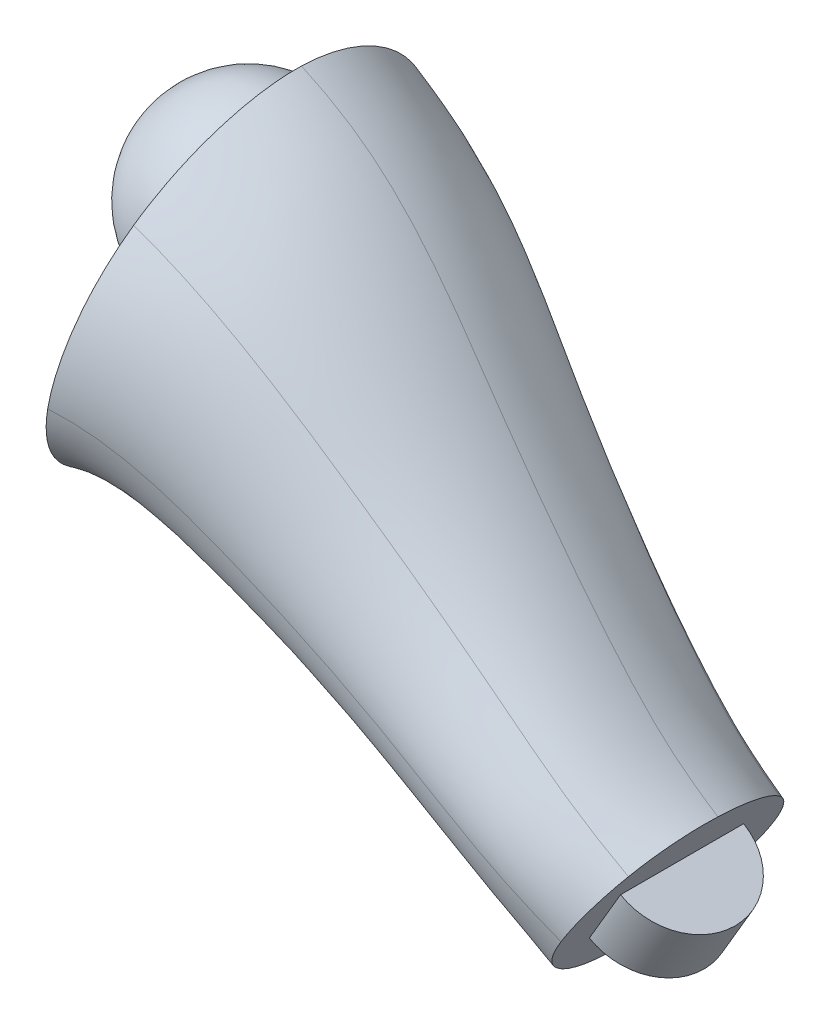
SolidWorks part; units mm, degrees
ref_plane "Front Plane" through (0, 0, 0) normal (0, 0, 1) x (1, 0, 0)
ref_plane "Top Plane" through (0, 0, 0) normal (0, 1, 0) x (1, 0, 0)
ref_plane "Right Plane" through (0, 0, 0) normal (1, 0, 0) x (0, 0, -1)
imported_body "Stock-Source-1"
ref_plane "Plane1" through (0, 0, 76.2) normal (0, 0, 1) x (1, 0, 0)
sketch "Sketch1" plane through (0, 0, 76.2) normal (0, 0, 1) x (1, 0, 0)
  line L0 (197.3326, 4157.5336) -> (184.2233, 4078.6048)
  line L2 (198.2044, 4162.7825) -> (193.7533, 4135.9835) construction
  arc A0 (184.2233, 4078.6048) -> (197.3326, 4157.5336) centre (190.7779, 4118.0692) cw
  dimension "D1" = 80.01
revolve "Revolve1" add sketch "Sketch1" angle 360 about L0
ref_plane "Plane2" through (0, 0, 81.28) normal (0, 0, 1) x (1, 0, 0)
sketch "Sketch2" plane through (0, 0, 81.28) normal (0, 0, 1) x (1, 0, 0)
  line L0 (374.7183, 3977.2364) -> (361.8536, 3955.3352)
  line L1 (381.5781, 3988.9145) -> (385.901, 3996.274) construction
  line L2 (361.8536, 3955.3352) -> (383.7548, 3942.4705)
  line L3 (383.7548, 3942.4705) -> (396.6195, 3964.3717)
  line L4 (396.6195, 3964.3717) -> (374.7183, 3977.2364)
  dimension "D1" = 25.4
  dimension "D2" = 25.4
revolve "Revolve2" add sketch "Sketch2" angle 360 about L0
